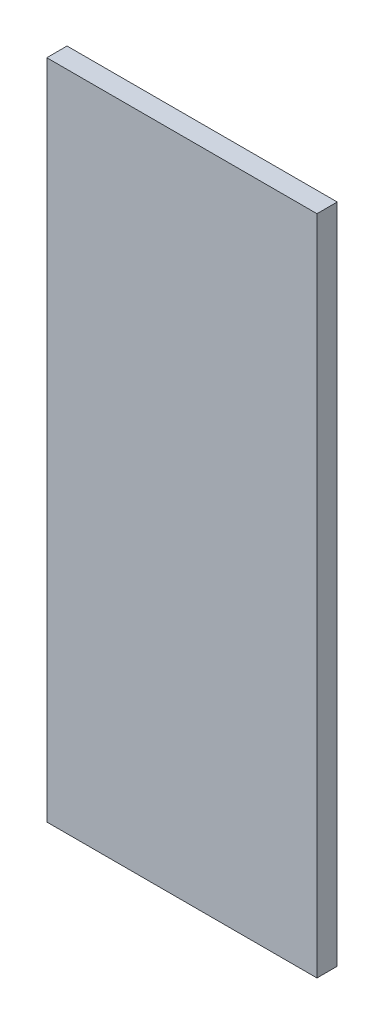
SolidWorks part; units mm, degrees
ref_plane "Plan de face" through (0, 0, 0) normal (0, 0, 1) x (1, 0, 0)
ref_plane "Plan de dessus" through (0, 0, 0) normal (0, 1, 0) x (1, 0, 0)
ref_plane "Plan de droite" through (0, 0, 0) normal (1, 0, 0) x (0, 0, -1)
sketch "Esquisse1" plane through (0, 0, 0) normal (0, 0, 1) x (1, 0, 0)
  line L1 (0, 0) -> (40, 0)
  line L2 (0, 0) -> (0, 98)
  line L3 (0, 98) -> (40, 98)
  line L4 (40, 0) -> (40, 98)
  dimension "D1" = 98
  dimension "D2" = 40
extrude "Boss.-Extru.1" add sketch "Esquisse1" along normal blind 3
